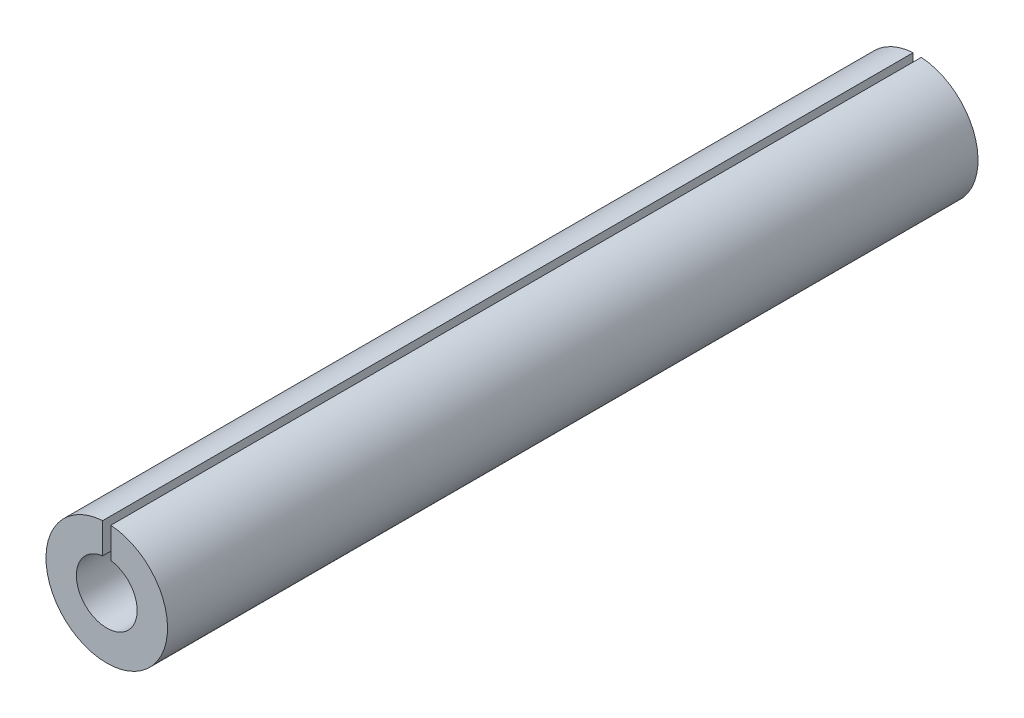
SolidWorks part; units mm, degrees
ref_plane "face" through (0, 0, 0) normal (0, 0, 1) x (1, 0, 0)
ref_plane "dessus" through (0, 0, 0) normal (0, 1, 0) x (1, 0, 0)
ref_plane "coté" through (0, 0, 0) normal (1, 0, 0) x (0, 0, -1)
sketch "Esquisse1" plane through (0, 0, 0) normal (0, 0, 1) x (1, 0, 0)
  circle A0 centre (0, 0) radius 1.5
  circle A1 centre (0, 0) radius 0.75
  dimension "D1" = 3
  dimension "D2" = 1.5
extrude "Base-Extrusion" add sketch "Esquisse1" along normal blind 20
sketch "Esquisse2" plane through (0, 0, 20) normal (0, 0, 1) x (1, 0, 0)
  line L0 (0, 0) -> (0, 0.0995) construction
  line L1 (-0.1, 1.5802) -> (0.1, 1.5802)
  line L2 (-0.1, 1.5802) -> (-0.1, 0)
  line L3 (-0.1, 0) -> (0.1, 0)
  line L4 (0.1, 1.5802) -> (0.1, 0)
  dimension "D1" = 0.2
extrude "Enlèv. mat.-Extru.1" cut sketch "Esquisse2" against normal through all
